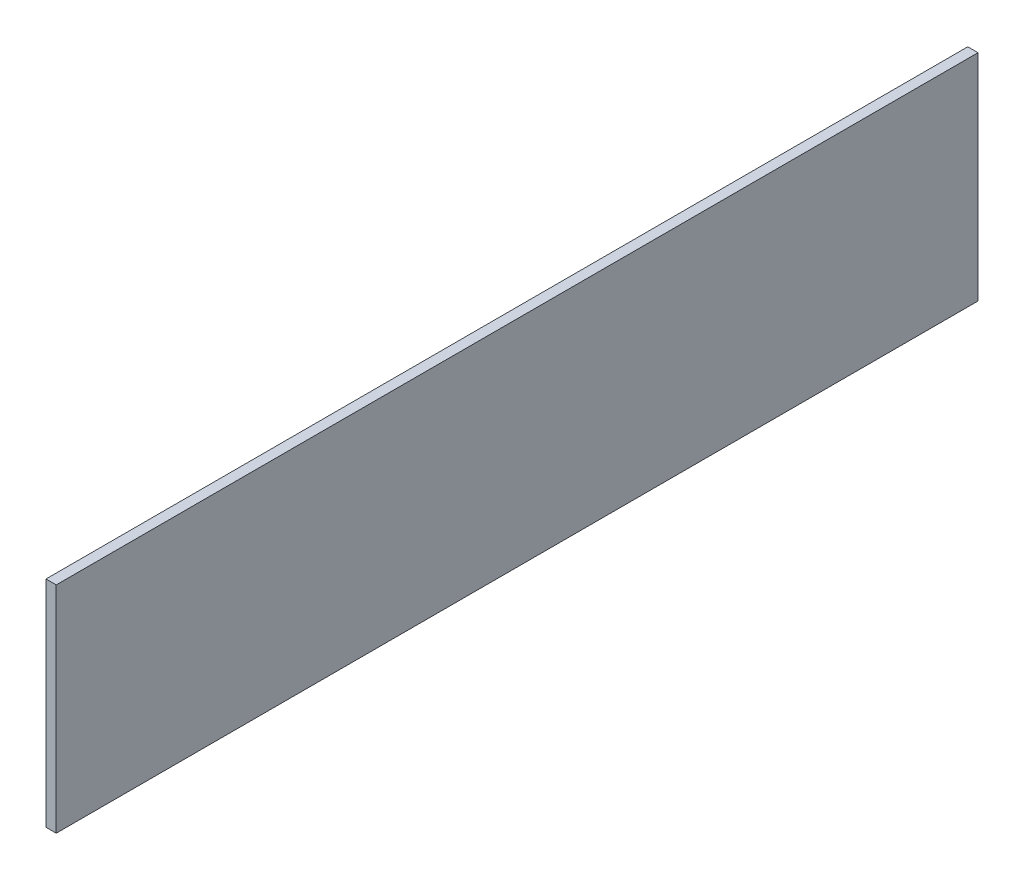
SolidWorks part; units mm, degrees
ref_plane "Front" through (0, 0, 0) normal (0, 0, 1) x (1, 0, 0)
ref_plane "Top" through (0, 0, 0) normal (0, 1, 0) x (1, 0, 0)
ref_plane "Right" through (0, 0, 0) normal (1, 0, 0) x (0, 0, -1)
sketch "Sketch1" plane through (0, 0, 0) normal (1, 0, 0) x (0, 0, -1)
  line L1 (0, 0) -> (285.75, 0)
  line L2 (0, 0) -> (0, 66.675)
  line L3 (0, 66.675) -> (285.75, 66.675)
  line L4 (285.75, 0) -> (285.75, 66.675)
  dimension "D1" = 285.75
  dimension "D2" = 66.675
extrude "Extrude1" add sketch "Sketch1" along normal blind 3.175
